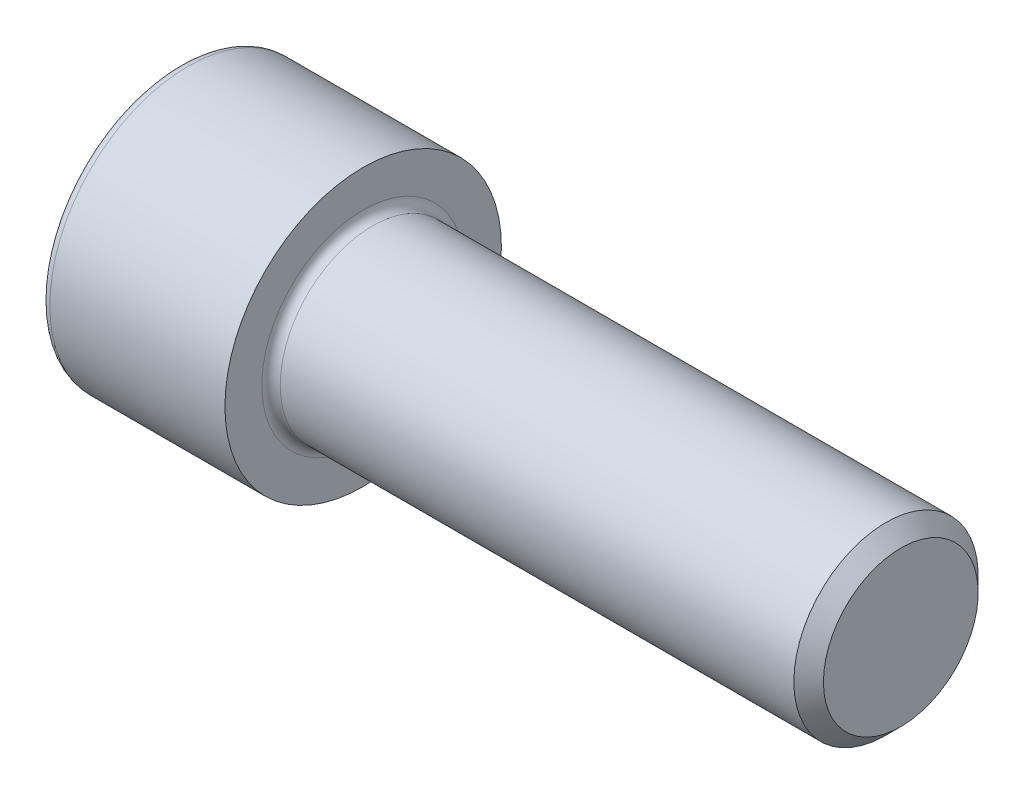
SolidWorks part; units mm, degrees
ref_plane "Plane1" through (0, 0, 0) normal (0, 0, 1) x (1, 0, 0)
ref_plane "Plane2" through (0, 0, 0) normal (0, 1, 0) x (1, 0, 0)
ref_plane "Plane3" through (0, 0, 0) normal (1, 0, 0) x (0, 0, -1)
sketch "BodySke" plane through (0, 0, 0) normal (0, 0, 1) x (1, 0, 0)
  line L0 (0, 0) -> (0, 9)
  line L1 (0, 9) -> (12, 9)
  line L2 (12, 9) -> (12, 6)
  line L3 (12, 6) -> (46.036, 6)
  line L4 (47, 5.036) -> (47, 0)
  line L5 (47, 0) -> (0, 0)
  line L6 (-31.75, 0) -> (127, 0) construction
  line L8 (47, 5.036) -> (46.036, 6)
  line L10 (47, -5.036) -> (46.036, -6) construction
  line L11 (13.75, 9.525) -> (13.75, 3.175) construction
  line L12 (12, 9.525) -> (12, 3.175) construction
  line L13 (-13, 9.525) -> (-13, 3.175) construction
  dimension "Diameter" = 12
  dimension "Head_ht" = 12
  dimension "Length" = 35
  dimension "Body_ch_ang" = 45
  dimension "Head_dia" = 18
  dimension "Minor_dia" = 10.072
  dimension "Advance" = 1.75
  dimension "Thread_nom" = 35
  dimension "Thread_length" = 60
revolve "Base-Revolve" add sketch "BodySke"
fillet "Fillet1" radius 0.6 1 edges at (12, 0, 6)
fillet "Fillet2" radius 0.6 1 edges at (0, 0, 9)
sketch "Sketch2" plane through (0, 0, 0) normal (0, 0, 1) x (1, 0, 0)
  line L0 (0, 5.0575) -> (6, 5.0575)
  line L1 (6, 5.0575) -> (8.9199, 0)
  line L2 (-31.75, 0) -> (127, 0) construction
  line L3 (8.9199, 0) -> (0, 0)
  line L4 (0, 0) -> (0, 5.0575)
  line L6 (0, 0) -> (47.625, 0) construction
  dimension "D1" = 5.0575
  dimension "D2" = 60
  dimension "Depth" = 6
revolve "Hex-PreBroach" cut sketch "Sketch2" angle 360 about L6
sketch "Sketch3" plane through (0, 0, 0) normal (-1, 0, 0) x (0, 0.5, 0.866)
  line L0 (2.9199, 5.0575) -> (-2.9199, 5.0575)
  line L1 (-2.9199, 5.0575) -> (-5.8399, 0)
  line L2 (2.9199, 5.0575) -> (5.8399, 0)
  line L3 (2.9199, -5.0575) -> (5.8399, 0)
  line L4 (2.9199, -5.0575) -> (-2.9199, -5.0575)
  line L5 (-2.9199, -5.0575) -> (-5.8399, 0)
  dimension "D1" = 5.0575
  dimension "D2" = 5.0575
  dimension "Hex_size" = 10.115
extrude "Hex" cut sketch "Sketch3" against normal blind 6
sketch "ThdSchSke" plane through (0, 0, 0) normal (0, 0, 1) x (1, 0, 0)
  line L0 (17.25, -5.036) -> (16.575, -6)
  line L1 (17.25, -5.036) -> (17.925, -6)
  line L2 (17.925, -6) -> (17.925, -7.5)
  line L3 (-3.175, 0) -> (5.1513, 0) construction
  line L4 (0, 8.4) -> (0, -8.4) construction
  line L5 (17.925, -7.5) -> (16.575, -7.5)
  line L6 (16.575, -7.5) -> (16.575, -6)
  dimension "Thread_minor" = 10.072
  dimension "Diameter" = 12
  dimension "Start" = 17.25
  dimension "SideAngle" = 55
  dimension "VeeAngle" = 70
  dimension "Overcut" = 15
revolve "ThreadSchematic" [suppressed] cut sketch "ThdSchSke" angle 360 about L3
pattern_linear "ThdSchPat" [suppressed]
equation "\"D2@Sketch3\" = \"Hex_size@Sketch3\" / 2"
equation "\"D1@Sketch3\" = \"Hex_size@Sketch3\" / 2"
equation "\"D1@Sketch2\" = \"Hex_size@Sketch3\" / 2"
equation "\"Thread_minor@ThreadCosmetic\"  =  \"Minor_dia@BodySke\""
equation "\"Depth@Sketch2\" =  \"Key_eng@Hex\""
equation "\"Thread_length@ThreadCosmetic\" = ((sgn( (\"Length@BodySke\" - \"Advance@BodySke\" * 3.0) - \"Thread_nom@BodySke\" )-1)*( (\"Length@BodySke\" - \"Advance@BodySke\" * 3.0) - \"Thread_nom@BodySke\" ))/-2+ \"Thread_no"
equation "\"Thread_minor@ThdSchSke\" = \"Minor_dia@BodySke\""
equation "\"Diameter@ThdSchSke\" = \"Diameter@BodySke\""
equation "\"Overcut@ThdSchSke\" = \"Diameter@BodySke\" * 1.25"
equation "\"Start@ThdSchSke\" = \"Head_ht@BodySke\" + \"Length@BodySke\" - \"Thread_length@ThreadCosmetic\"  '---Non-countersunk---"
equation "\"Num_threads@ThdSchPat\" = int( \"Thread_length@ThreadCosmetic\" / \"Advance@BodySke\" + 0.999 )  + 1"
equation "\"Advance@ThdSchPat\" = \"Thread_length@ThreadCosmetic\" /  (\"Num_threads@ThdSchPat\" - 1) 'relax it"
equation "\"Num_threads@ThdSchPat\" = \"Num_threads@ThdSchPat\" - sgn( \"Num_threads@ThdSchPat\" - 1) '---chamfered tips only---"
